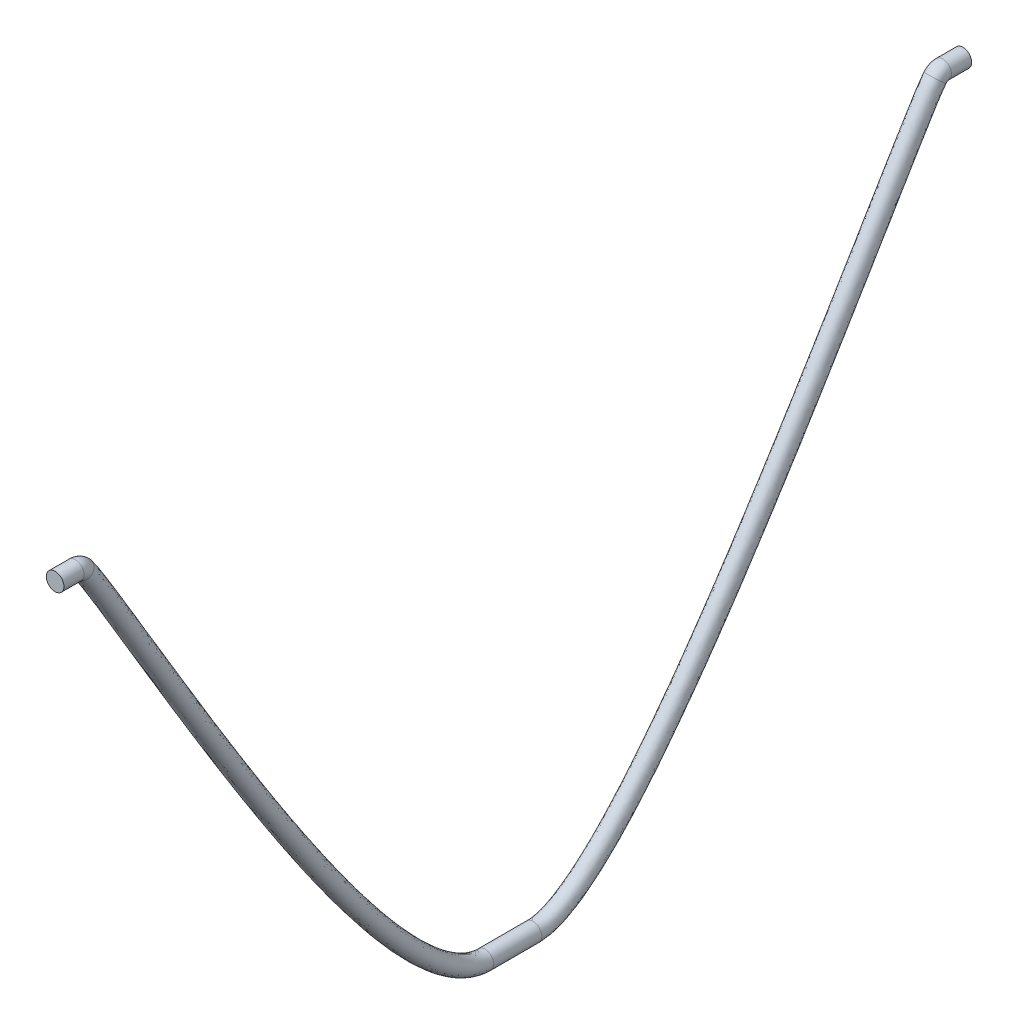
SolidWorks part; units mm, degrees
ref_plane "Front Plane" through (0, 0, 0) normal (0, 0, 1) x (1, 0, 0)
ref_plane "Top Plane" through (0, 0, 0) normal (0, 1, 0) x (1, 0, 0)
ref_plane "Right Plane" through (0, 0, 0) normal (1, 0, 0) x (0, 0, -1)
sketch "Sketch2" plane through (0, 0, 0) normal (1, 0, 0) x (0, 0, -1)
  line L0 (-135.3505, 121.207) -> (-130.5849, 121.207)
  line L3 (-87.9677, 174.9543) -> (-89.9695, 174.9543)
  line L4 (-132.9677, 93.4543) -> (-132.9677, 82.4543) construction
  line L5 (-177.9677, 174.9543) -> (-175.9658, 174.9543)
  arc A1 (-90.7296, 174.6041) -> (-89.9695, 174.9543) centre (-89.9695, 173.9543) cw
  arc A2 (-175.2057, 174.6041) -> (-175.9658, 174.9543) centre (-175.9658, 173.9543) ccw
  spline S0 degree 3 poles (-175.2057, 174.6041) (-174.4323, 173.6994) (-159.7745, 148.5808) (-142.1037, 121.207) (-135.3505, 121.207) knots 0.056791 0.056791 0.056791 0.056791 0.331466 1 1 1 1
  spline S1 degree 3 poles (-90.7296, 174.6041) (-91.5031, 173.6994) (-106.1608, 148.5808) (-123.8316, 121.207) (-130.5849, 121.207) knots 0.056791 0.056791 0.056791 0.056791 0.331466 1 1 1 1
  dimension "D1" = 1
ref_plane "Plane1" through (0, 174.9543, 87.9677) normal (0, 0, 1) x (-1, 0, 0)
sketch "Sketch33" plane through (0, 174.9543, 87.9677) normal (0, 0, 1) x (-1, 0, 0)
  circle A0 centre (0, 0) radius 0.875
  dimension "D1" = 1.75
sweep "Sweep2" add profiles "Sketch33" path "Sketch2"
